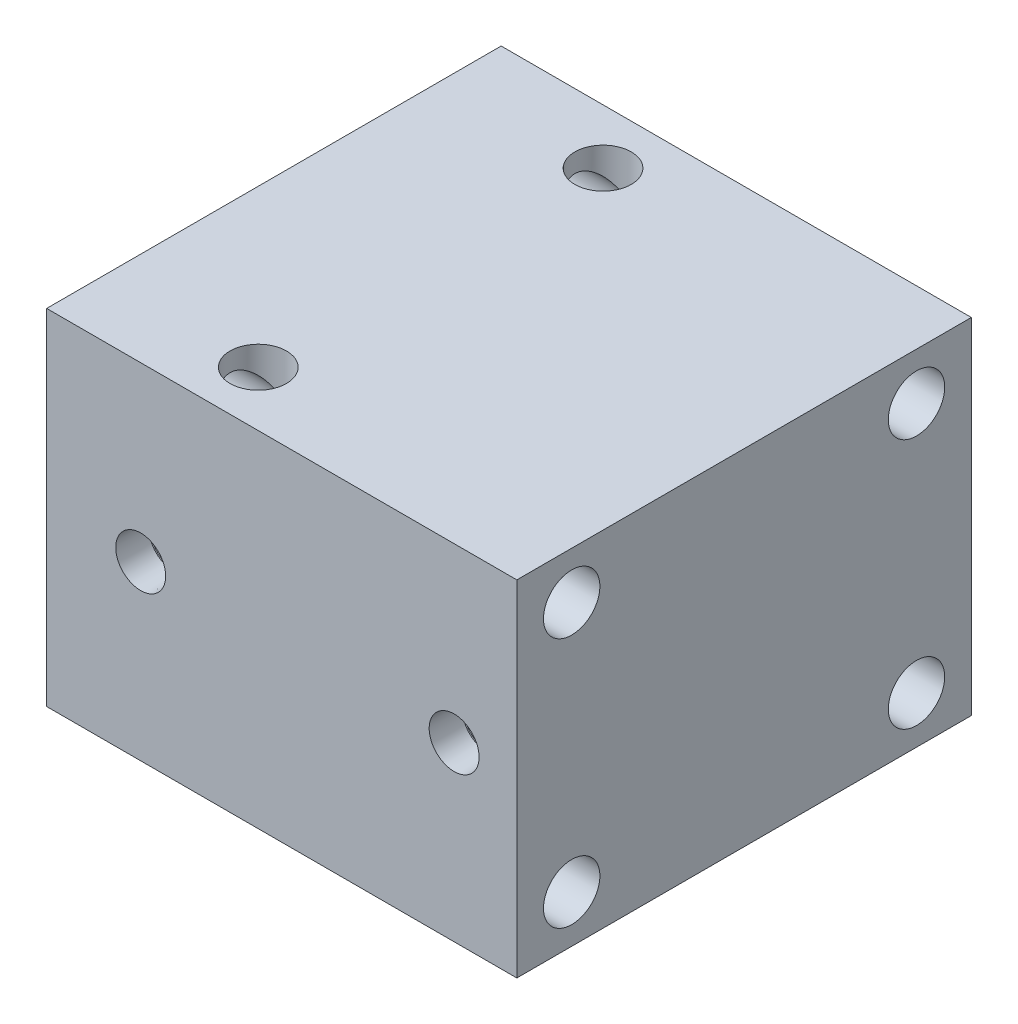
SolidWorks part; units mm, degrees
ref_plane "Front Plane" through (0, 0, 0) normal (0, 0, 1) x (1, 0, 0)
ref_plane "Top Plane" through (0, 0, 0) normal (0, 1, 0) x (1, 0, 0)
ref_plane "Right Plane" through (0, 0, 0) normal (1, 0, 0) x (0, 0, -1)
sketch "Sketch1" plane through (0, 0, 0) normal (0, 1, 0) x (1, 0, 0)
  line L0 (-25, 55) -> (-25, -55) construction
  line L1 (-75, 72.5) -> (75, 72.5)
  line L2 (-75, 72.5) -> (-75, -72.5)
  line L3 (-75, -72.5) -> (75, -72.5)
  line L4 (75, 72.5) -> (75, -72.5)
  line L5 (-75, 0) -> (-25, 0) construction
  circle A0 centre (-25, 55) radius 9
  circle A1 centre (-25, -55) radius 9
  dimension "D5" = 18
  dimension "D6" = 18
  dimension "D8" = 50
  dimension "D1" = 145
  dimension "D2" = 72.5
  dimension "D3" = 150
  dimension "D4" = 75
  dimension "D7" = 110
extrude "H1" add sketch "Sketch1" along normal blind 110
sketch "Sketch2" plane through (-75, 0, 0) normal (-1, 0, 0) x (0, 0, 1)
  line L0 (0, 0) -> (0, 55) construction
  line L1 (72.5, 55) -> (0, 55) construction
  line L2 (72.5, 110) -> (72.5, 0) construction
  circle A0 centre (0, 55) radius 1.5
  dimension "D1" = 3
extrude "CENTER HOLE" cut sketch "Sketch2" against normal blind 60
hole_wizard "3/8 NPT Tapped Hole1" positions "Sketch4" profile "Sketch3" size "3/8" standard "Ansi Inch"
sketch "Sketch4" plane through (0, 0, 72.5) normal (0, 0, 1) x (1, 0, 0)
  line L0 (-75, 55) -> (75, 55) construction
  line L1 (-75, 110) -> (-75, 0) construction
  line L2 (75, 110) -> (75, 0) construction
  point P0 (55, 55)
  point P1 (-45, 55)
  dimension "D1" = 30
  dimension "D2" = 20
sketch "Sketch3" plane through (55, 55, 72.5) normal (1, 0, 0) x (0, -1, 0)
  line L0 (0, 0) -> (0, 21.6686)
  line L1 (7.1374, 17.38) -> (0, 21.6686)
  line L2 (-7.1374, 17.38) -> (0, 21.6686) construction
  line L3 (7.1374, 17.38) -> (7.1374, 10.33)
  line L4 (7.1374, 10.33) -> (7.6537, 10.33)
  line L5 (7.6537, 10.33) -> (7.963, 0)
  line L6 (-7.6537, 10.33) -> (-7.963, 0) construction
  line L7 (7.963, 0) -> (0, 0)
  line L8 (0, -6.35) -> (0, 107.95) construction
  line L11 (-7.1374, 10.33) -> (-7.6537, 10.33) construction
  dimension "Tap Drill Dia." = 14.2748
  dimension "Tap Drill Depth" = 17.38
  dimension "Thread Dia." = 15.9261
  dimension "Thread Angle" = 3.43
  dimension "Thread Depth" = 10.33
  dimension "Drill Angle" = 118
sketch "Sketch6" plane through (-75, 0, 0) normal (-1, 0, 0) x (0, 0, 1)
  line L0 (-55, 110) -> (-55, 0) construction
  line L1 (55, 110) -> (55, 0) construction
  line L3 (-55, 95) -> (55, 95) construction
  line L5 (-55, 15) -> (55, 15) construction
  circle A0 centre (-55, 95) radius 9
  circle A1 centre (-55, 15) radius 9
  circle A2 centre (55, 95) radius 9
  circle A3 centre (55, 15) radius 9
  dimension "D3" = 18
  dimension "D1" = 40
  dimension "D2" = 80
extrude "MTG HOLE" cut sketch "Sketch6" against normal up to surface (150 mm away)
sketch "Sketch5" plane through (0, 0, 72.5) normal (0, 0, 1) x (1, 0, 0)
  circle A0 centre (-45, 55) radius 2
  circle A1 centre (55, 55) radius 2
  circle A2 centre (55, 55) radius 7.963 construction
  circle A3 centre (-45, 55) radius 7.963 construction
  dimension "D1" = 4
  dimension "D2" = 4
extrude "OIL HOLE" cut sketch "Sketch5" against normal blind 30
equation "\"D1@Sketch6\"=\"D2@Sketch6\"/2"
equation "\"D5@Sketch1\" = \"D6@Sketch1\""
equation "\"D2@Sketch1\" = \"D1@Sketch1\"/2"
equation "\"D4@Sketch1\"=\"D3@Sketch1\" / 2"
